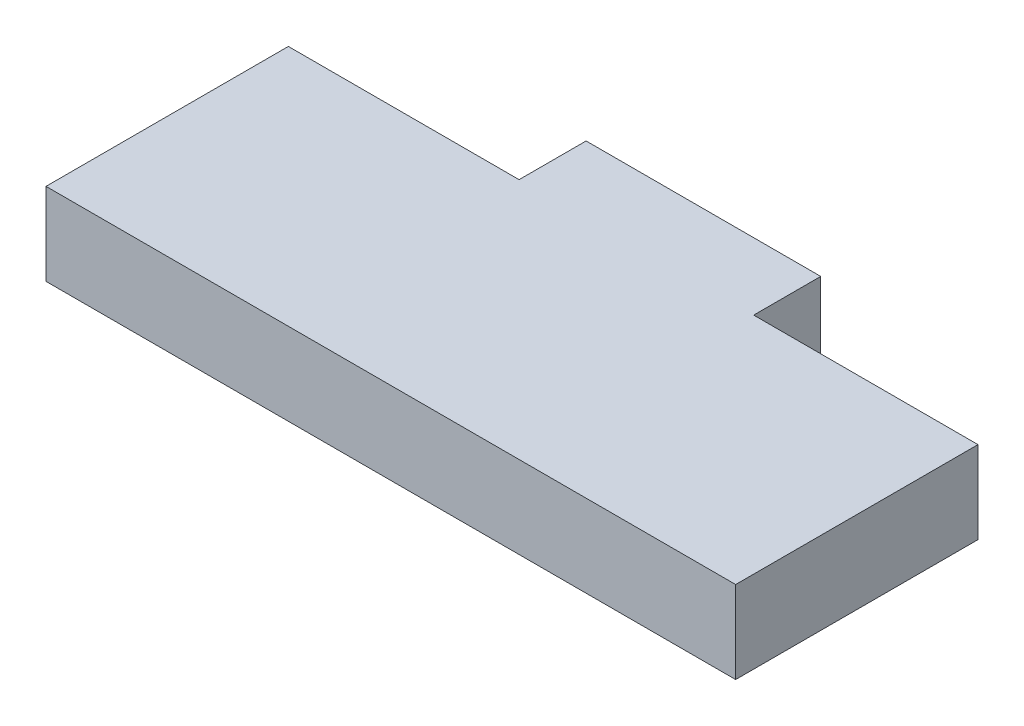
SolidWorks part; units mm, degrees
ref_plane "Front Plane" through (0, 0, 0) normal (0, 0, 1) x (1, 0, 0)
ref_plane "Top Plane" through (0, 0, 0) normal (0, 1, 0) x (1, 0, 0)
ref_plane "Right Plane" through (0, 0, 0) normal (1, 0, 0) x (0, 0, -1)
sketch "Sketch1" plane through (0, 0, 0) normal (0, 1, 0) x (1, 0, 0)
  line L0 (-10.022, 8.1429) -> (18.478, 8.1429)
  line L1 (18.478, 8.1429) -> (18.478, 0)
  line L2 (18.478, 0) -> (45.7253, 0)
  line L3 (45.7253, 0) -> (45.7253, -29.4396)
  line L4 (45.7253, -29.4396) -> (-38.0522, -29.4396)
  line L5 (-38.0522, -29.4396) -> (-38.0522, 0)
  line L6 (-38.0522, 0) -> (-10.022, 0)
  line L7 (-10.022, 0) -> (-10.022, 8.1429)
  dimension "D1" = 28.5
extrude "Boss-Extrude1" add sketch "Sketch1" along normal blind 10
